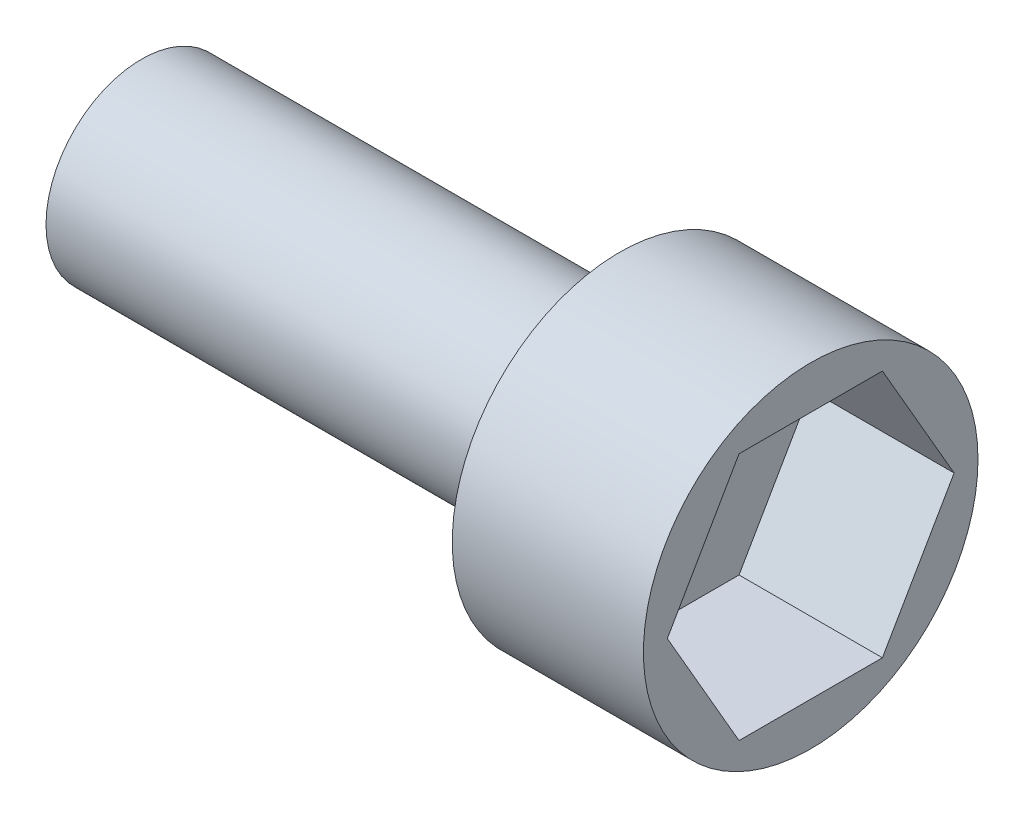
SolidWorks part; units mm, degrees
ref_plane "Front Plane" through (0, 0, 0) normal (0, 0, 1) x (1, 0, 0)
ref_plane "Top Plane" through (0, 0, 0) normal (0, 1, 0) x (1, 0, 0)
ref_plane "Right Plane" through (0, 0, 0) normal (1, 0, 0) x (0, 0, -1)
sketch "Sketch1" plane through (0, 0, 0) normal (1, 0, 0) x (0, 0, -1)
  circle A0 centre (0, 0) radius 2
  dimension "D1" = 4
extrude "Boss-Extrude1" add sketch "Sketch1" along normal blind 10
sketch "Sketch2" plane through (10, 0, 0) normal (1, 0, 0) x (0, 0, -1)
  circle A0 centre (0, 0) radius 3.5
  dimension "D1" = 7
extrude "Boss-Extrude2" add sketch "Sketch2" along normal blind 4
sketch "Sketch3" plane through (14, 0, 0) normal (1, 0, 0) x (0, 0, -1)
  line L1 (-3, 0) -> (-1.5, -2.5981)
  line L2 (-1.5, -2.5981) -> (1.5, -2.5981)
  line L3 (1.5, -2.5981) -> (3, 0)
  line L4 (3, 0) -> (1.5, 2.5981)
  line L5 (1.5, 2.5981) -> (-1.5, 2.5981)
  line L6 (-1.5, 2.5981) -> (-3, 0)
  circle A0 centre (0, 0) radius 2.5981 construction
  dimension "D1" = 3
extrude "Cut-Extrude1" cut sketch "Sketch3" against normal blind 3
